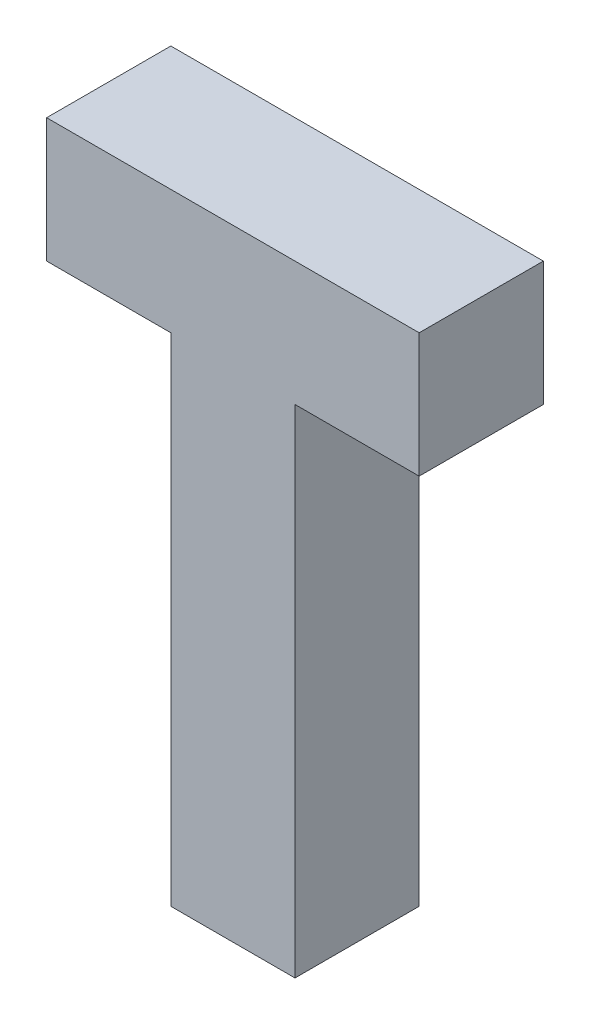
SolidWorks part; units mm, degrees
ref_plane "Plan de face" through (0, 0, 0) normal (0, 0, 1) x (1, 0, 0)
ref_plane "Plan de dessus" through (0, 0, 0) normal (0, 1, 0) x (1, 0, 0)
ref_plane "Plan de droite" through (0, 0, 0) normal (1, 0, 0) x (0, 0, -1)
sketch "Esquisse1" plane through (0, 0, 0) normal (0, 0, 1) x (1, 0, 0)
  line L0 (10, 40) -> (20, 40)
  line L1 (0, 0) -> (10, 0)
  line L2 (0, 0) -> (0, 40)
  line L4 (10, 0) -> (10, 40)
  line L5 (-10, 40) -> (0, 40)
  line L6 (-10, 40) -> (-10, 50)
  line L7 (-10, 50) -> (20, 50)
  line L8 (20, 40) -> (20, 50)
  dimension "D1" = 30
  dimension "D2" = 50
  dimension "D3" = 10
  dimension "D4" = 10
  dimension "D5" = 10
extrude "Boss.-Extru.1" add sketch "Esquisse1" along normal blind 10
